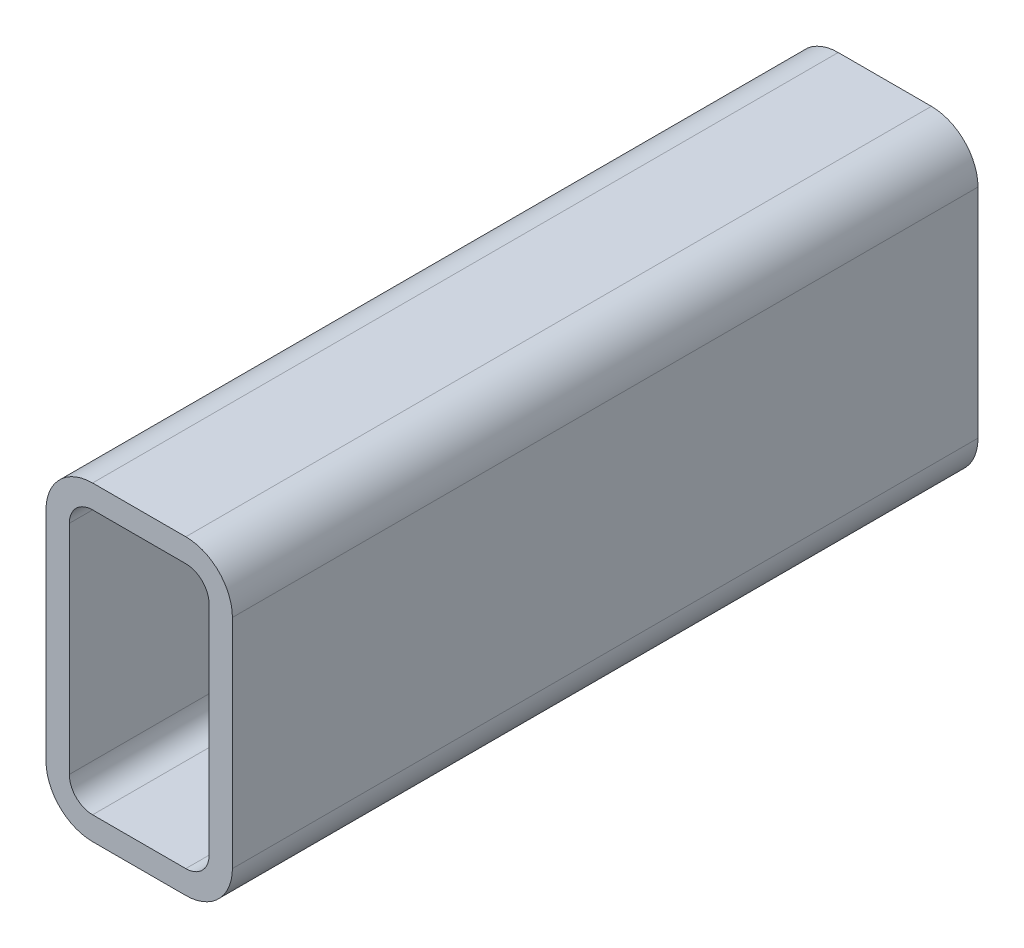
SolidWorks part; units mm, degrees
ref_plane "Front Plane" through (0, 0, 0) normal (0, 0, 1) x (1, 0, 0)
ref_plane "Top Plane" through (0, 0, 0) normal (0, 1, 0) x (1, 0, 0)
ref_plane "Right Plane" through (0, 0, 0) normal (1, 0, 0) x (0, 0, -1)
sketch "Sketch1" plane through (0, 0, 0) normal (0, 0, 1) x (1, 0, 0)
sketch_block_instance "HSS5x3x0.375-1"
sketch_block "HSS5x3x0.375"
extrude "Boss-Extrude1" add sketch "Sketch1" along normal blind 304.8
